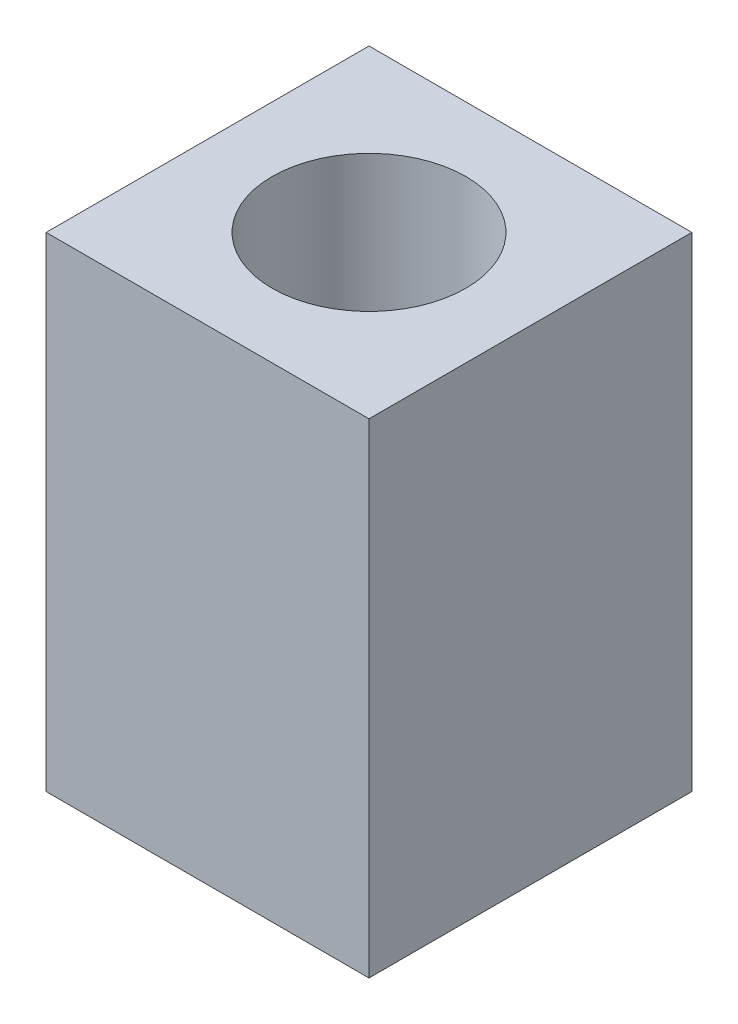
SolidWorks part; units mm, degrees
ref_plane "Face" through (0, 0, 0) normal (0, 0, 1) x (1, 0, 0)
ref_plane "Dessus" through (0, 0, 0) normal (0, 1, 0) x (1, 0, 0)
ref_plane "Droite" through (0, 0, 0) normal (1, 0, 0) x (0, 0, -1)
sketch "Esquisse1" plane through (0, 0, 0) normal (0, 0, 1) x (1, 0, 0)
  line L1 (-50, 85) -> (50, 85)
  line L2 (-50, 85) -> (-50, -65)
  line L3 (-50, -65) -> (50, -65)
  line L4 (50, 85) -> (50, -65)
  dimension "D1" = 100
  dimension "D2" = 150
  dimension "D3" = 85
  dimension "D4" = 50
extrude "Extrusion1" add sketch "Esquisse1" along normal blind 100
sketch "Esquisse2" plane through (0, 85, 0) normal (0, 1, 0) x (-1, 0, 0)
  line L0 (0, -15.4824) -> (0, 111.651) construction
  line L1 (-54.5106, 50) -> (53.2915, 50) construction
  line L2 (-50, 0) -> (50, 0) construction
  line L3 (-50, 100) -> (50, 100) construction
  line L4 (-50, 100) -> (-50, 0) construction
  line L5 (50, 100) -> (50, 0) construction
  circle A0 centre (0, 50) radius 30
  dimension "D1" = 60
extrude "Enlèv. mat.-Extru.1" cut sketch "Esquisse2" against normal blind 100
sketch "Esquisse3" plane through (0, -15, 0) normal (0, 1, 0) x (-1, 0, 0)
  line L0 (0, -12.8701) -> (0, 109.7353) construction
  line L1 (-71.3715, 50) -> (67.7716, 50) construction
  circle A1 centre (0, 50) radius 22
  circle A2 centre (0, 50) radius 30 construction
  dimension "D1" = 44
extrude "Enlèv. mat.-Extru.2" cut sketch "Esquisse3" against normal blind 30 draft 5
ref_plane "Plan1" through (0, 0, 50) normal (0, 0, 1) x (1, 0, 0)
sketch "Esquisse4" plane through (0, 0, 50) normal (0, 0, 1) x (1, 0, 0)
  line L0 (0, 70.3448) -> (0, -77.5096) construction
  line L1 (0, -15) -> (0, 85) construction
  line L2 (-19.2403, -46.5436) -> (-19.7253, -41)
  line L3 (-18.7422, -47) -> (-15.7422, -47)
  line L4 (-15.2441, -46.5436) -> (-14.7591, -41)
  line L5 (-19.7253, -41) -> (-14.7591, -41)
  line L6 (-22, -15) -> (-19.3753, -45) construction
  line L7 (19.3753, -45) -> (-19.3753, -45) construction
  arc A0 (-18.7422, -47) -> (-19.2403, -46.5436) centre (-18.7422, -46.5) cw
  arc A1 (-15.2441, -46.5436) -> (-15.7422, -47) centre (-15.7422, -46.5) cw
  dimension "D1" = 0.5
  dimension "D2" = 2
  dimension "D3" = 3
  dimension "D4" = 6
  dimension "D5" = 10
revolve "Enlèvement de matière-Révolution1" cut sketch "Esquisse4" angle 360 about L0
sketch "Esquisse5" plane through (0, 85, 0) normal (0, 1, 0) x (-1, 0, 0)
  line L0 (60, 50) -> (-60, 50)
  line L1 (-60, 50) -> (-60, 110)
  line L2 (-60, 110) -> (60, 110)
  line L3 (60, 110) -> (60, 50)
  line L4 (-50, 0) -> (50, 0) construction
  line L5 (-50, 100) -> (-50, 0) construction
  dimension "D1" = 50
  dimension "D2" = 60
  dimension "D3" = 120
  dimension "D4" = 10
extrude "Enlèv. mat.-Extru.3" cut sketch "Esquisse5" against normal through all
